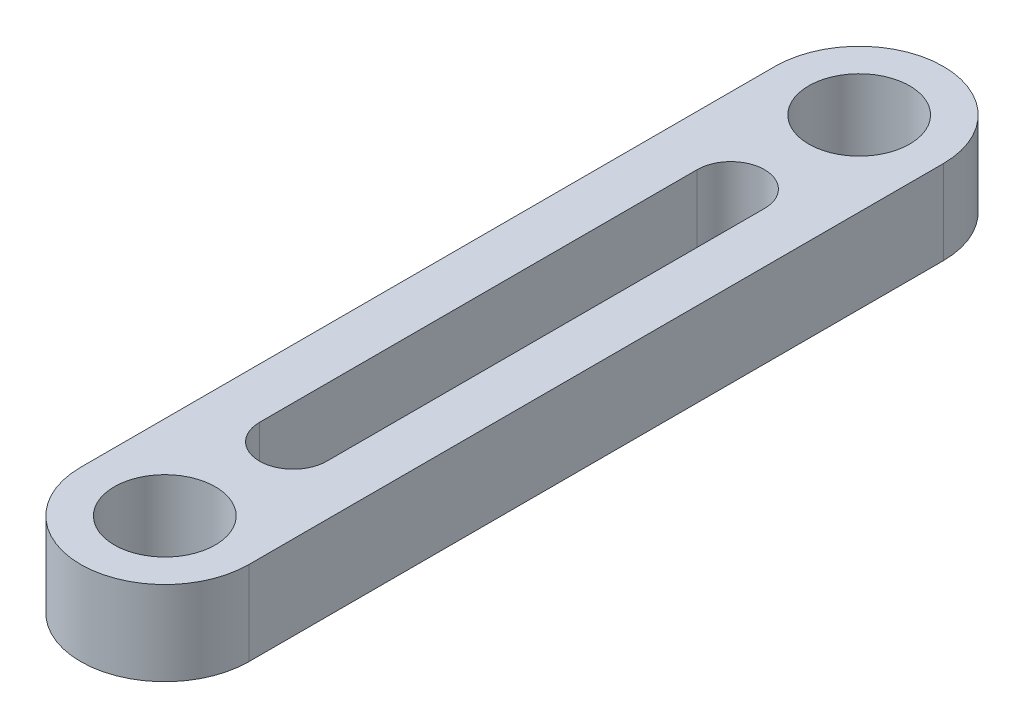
SolidWorks part; units mm, degrees
ref_plane "Plan de face" through (0, 0, 0) normal (0, 0, 1) x (1, 0, 0)
ref_plane "Plan de dessus" through (0, 0, 0) normal (0, 1, 0) x (1, 0, 0)
ref_plane "Plan de droite" through (0, 0, 0) normal (1, 0, 0) x (0, 0, -1)
sketch "Esquisse1" plane through (0, 0, 0) normal (0, 1, 0) x (1, 0, 0)
  line L2 (-8.6233, 41.25) -> (-8.6233, -41.25)
  line L4 (11.3767, 41.25) -> (11.3767, -41.25)
  arc A0 (11.3767, 41.25) -> (-8.6233, 41.25) centre (1.3767, 41.25) ccw
  arc A1 (-8.6233, -41.25) -> (11.3767, -41.25) centre (1.3767, -41.25) ccw
  arc A2 (11.3767, 41.25) -> (-8.6233, 41.25) centre (1.3767, 41.25) ccw
  circle A3 centre (1.3767, -41.25) radius 6
  circle A5 centre (1.3767, 41.25) radius 6
  point P0 (0, 0)
  dimension "D3" = 20
  dimension "D4" = 12
  dimension "D5" = 82.5
  dimension "D8" = 12
  dimension "D1" = 20
  dimension "D2" = 20
extrude "Extrusion1" add sketch "Esquisse1" against normal blind 10
sketch "Esquisse2" plane through (0, 0, 0) normal (0, 1, 0) x (-1, 0, 0)
  line L0 (-1.3767, -26) -> (-1.3767, 26) construction
  line L1 (-5.3767, -26) -> (-5.3767, 26)
  line L2 (2.6233, -26) -> (2.6233, 26)
  line L3 (-11.3767, -41.25) -> (-11.3767, 41.25) construction
  line L4 (0, 0) -> (-26.2424, 0) construction
  line L5 (8.6233, -41.25) -> (8.6233, 41.25) construction
  arc A0 (-5.3767, -26) -> (2.6233, -26) centre (-1.3767, -26) ccw
  arc A1 (2.6233, 26) -> (-5.3767, 26) centre (-1.3767, 26) ccw
  point P2 (-1.3767, 0)
  dimension "D3" = 4
  dimension "D2" = 52
extrude "Extrusion2" cut sketch "Esquisse2" against normal blind 10
